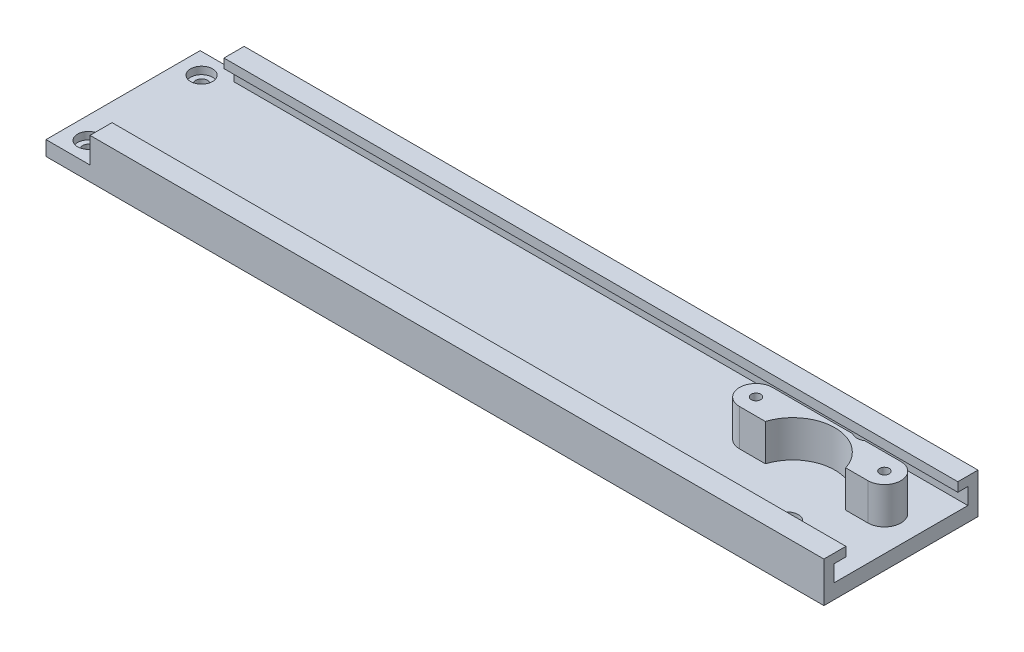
SolidWorks part; units mm, degrees
ref_plane "Front Plane" through (0, 0, 0) normal (0, 0, 1) x (1, 0, 0)
ref_plane "Top Plane" through (0, 0, 0) normal (0, 1, 0) x (1, 0, 0)
ref_plane "Right Plane" through (0, 0, 0) normal (1, 0, 0) x (0, 0, -1)
sketch "Sketch1" plane through (0, 0, 0) normal (0, 1, 0) x (1, 0, 0)
  line L1 (-106, -21) -> (106, -21)
  line L2 (-106, -21) -> (-106, 21)
  line L3 (-106, 21) -> (106, 21)
  line L4 (106, -21) -> (106, 21)
  line L5 (-106, -21) -> (106, 21) construction
  line L6 (-106, 21) -> (106, -21) construction
  point P0 (0, 0)
  dimension "D1" = 212
  dimension "D2" = 42
extrude "Boss-Extrude1" add sketch "Sketch1" along normal blind 4 contours L1 L4 L3 L2
sketch "Sketch2" plane through (106, 0, 0) normal (1, 0, 0) x (0, 0, -1)
  line L0 (-21, 0) -> (-21, 11)
  line L1 (-21, 11) -> (-15, 11)
  line L2 (-15, 11) -> (-15, 8.5)
  line L3 (-15, 8.5) -> (-18.25, 8.5)
  line L4 (-18.25, 8.5) -> (-18.25, 0)
  line L5 (-21, 0) -> (21, 0) construction
  line L6 (-18.25, 0) -> (-21, 0)
  line L7 (0, 0) -> (0, 22.7906) construction
  line L8 (18.25, 8.5) -> (18.25, 0)
  line L9 (15.5, 8.5) -> (18.25, 8.5)
  line L10 (15.5, 11) -> (15.5, 8.5)
  line L11 (21, 11) -> (15.5, 11)
  line L12 (21, 0) -> (21, 11)
  line L13 (18.25, 0) -> (21, 0)
  dimension "D1" = 11
  dimension "D2" = 6
  dimension "D3" = 2.5
  dimension "D4" = 3.25
  dimension "D5" = 2.75
  dimension "D6" = 2.5
extrude "Boss-Extrude2" add sketch "Sketch2" against normal blind 200
sketch "Sketch3" plane through (0, 4, 0) normal (0, 1, 0) x (1, 0, 0)
  line L0 (-106, -21) -> (-106, 21) construction
  line L1 (-106, -21) -> (-94, -21) construction
  circle A0 centre (-100, -15.4) radius 3
  dimension "D1" = 6
  dimension "D2" = 6
  dimension "D3" = 5.6
extrude "Cut-Extrude1" cut sketch "Sketch3" against normal blind 2
sketch "Sketch4" plane through (0, 2, 0) normal (0, 1, 0) x (1, 0, 0)
  circle A0 centre (-100, -15.4) radius 1.6
  dimension "D1" = 3.2
extrude "Cut-Extrude2" cut sketch "Sketch4" against normal through all
mirror "Mirror1" about plane through (0, 0, 0) normal (0, 0, 1) of "Cut-Extrude1", "Cut-Extrude2"
sketch "Sketch5" plane through (0, 4, 0) normal (0, 1, 0) x (1, 0, 0)
  line L0 (61.5, 5) -> (96.5, 5) construction
  line L1 (61.5, 9.5) -> (96.5, 9.5)
  line L2 (61.5, 0.5) -> (96.5, 0.5)
  line L3 (106, -18.25) -> (106, 18.25) construction
  arc A0 (61.5, 9.5) -> (61.5, 0.5) centre (61.5, 5) ccw
  arc A1 (96.5, 0.5) -> (96.5, 9.5) centre (96.5, 5) ccw
  circle A2 centre (96.5, 5) radius 1.3
  circle A3 centre (61.5, 5) radius 1.3
  point P2 (79, 5)
  dimension "D1" = 4.5
  dimension "D2" = 2.6
  dimension "D3" = 2.6
  dimension "D5" = 23.25
  dimension "D4" = 35
  dimension "D6" = 9.5
extrude "Boss-Extrude3" add sketch "Sketch5" along normal blind 10
sketch "Sketch6" plane through (0, 4, 0) normal (0, 1, 0) x (1, 0, 0)
  line L0 (106, -18.25) -> (106, 18.25) construction
  line L4 (-94, 21) -> (106, 21) construction
  circle A0 centre (85, 12) radius 3
  circle A1 centre (85, -10) radius 3
  dimension "D1" = 6
  dimension "D2" = 6
  dimension "D4" = 22
  dimension "D5" = 9
  dimension "D3" = 21
extrude "Cut-Extrude3" cut sketch "Sketch6" against normal blind 2 contours A1 | A0
sketch "Sketch8" plane through (0, 2, 0) normal (0, 1, 0) x (1, 0, 0)
  circle A0 centre (85, 12) radius 1.6
  circle A1 centre (85, -10) radius 1.6
  dimension "D1" = 3.2
  dimension "D2" = 3.2
extrude "Cut-Extrude4" cut sketch "Sketch8" against normal through all contours A0 | A1
sketch "Sketch9" plane through (0, 14, 0) normal (0, 1, 0) x (1, 0, 0)
  line L0 (61.5, 0.5) -> (96.5, 0.5) construction
  line L1 (96.5, 9.5) -> (61.5, 9.5) construction
  circle A0 centre (61.5, 5) radius 1.3 construction
  circle A1 centre (96.5, 5) radius 1.3 construction
  circle A2 centre (96.5, 5) radius 1.3 construction
  circle A3 centre (79, -2.9509) radius 11.4618
  point P0 (68.07, 0.5)
  point P6 (89.93, 0.5)
  point P8 (79.5, 8.5)
  dimension "D1" = 6.57
  dimension "D4" = 17
  dimension "D5" = 22.9237
  dimension "D2" = 6.57
  dimension "D3" = 1
sketch "Sketch10" plane through (0, 14, 0) normal (0, 1, 0) x (1, 0, 0)
  line L0 (96.5, 9.5) -> (86.6583, 9.5) construction
  circle A0 centre (79.5, -3) radius 11.5
  circle A1 centre (96.5, 5) radius 1.3 construction
  dimension "D1" = 17
  dimension "D2" = 23
  dimension "D3" = 12.5
extrude "Cut-Extrude5" cut sketch "Sketch10" against normal up to surface (10 mm away)
sketch "Sketch11" plane through (0, 14, 0) normal (0, 1, 0) x (1, 0, 0)
  circle A0 centre (85, 12) radius 3
  dimension "D1" = 6
extrude "Cut-Extrude6" cut sketch "Sketch11" against normal up to next
